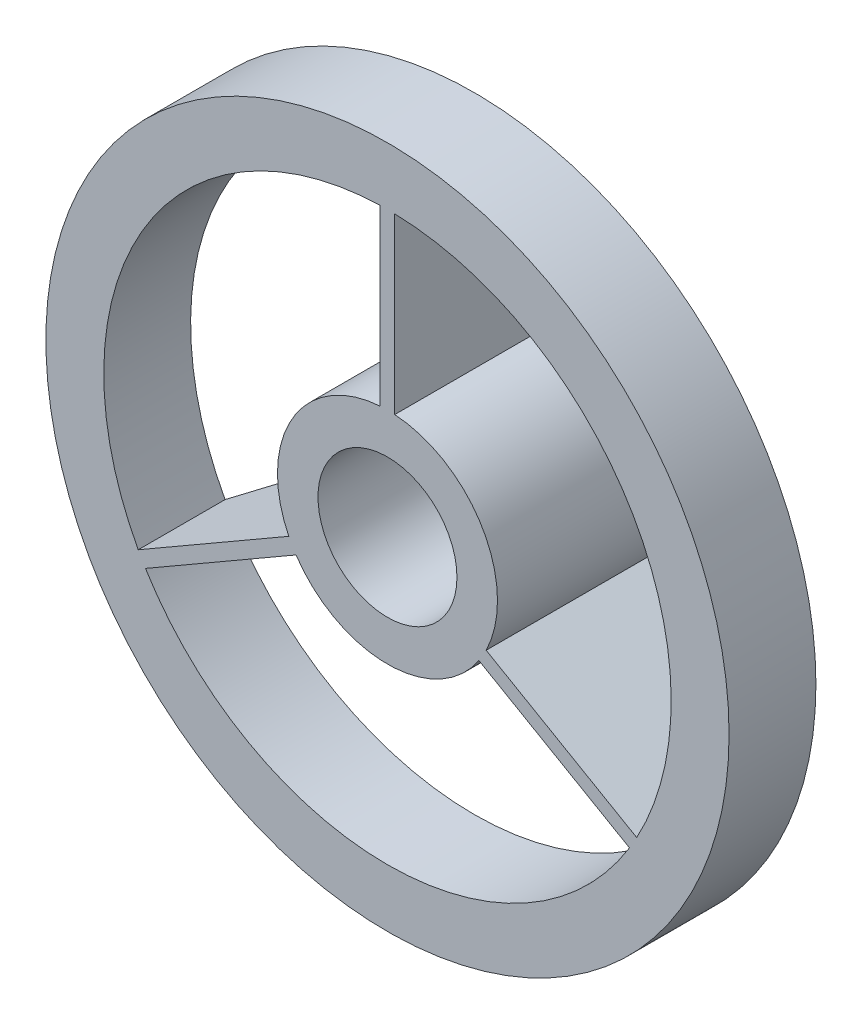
SolidWorks part; units mm, degrees
ref_plane "Front Plane" through (0, 0, 0) normal (0, 0, 1) x (1, 0, 0)
ref_plane "Top Plane" through (0, 0, 0) normal (0, 1, 0) x (1, 0, 0)
ref_plane "Right Plane" through (0, 0, 0) normal (1, 0, 0) x (0, 0, -1)
sketch "Croquis1" plane through (0, 0, 0) normal (0, 0, 1) x (1, 0, 0)
  circle A0 centre (0, 0) radius 1.2
  circle A1 centre (0, 0) radius 1.9
  dimension "D1" = 2.4
  dimension "D2" = 0.7
extrude "Saliente-Extruir1" add sketch "Croquis1" along normal blind 3.5
sketch "Croquis2" plane through (0, 0, 3.5) normal (0, 0, 1) x (1, 0, 0)
  circle A1 centre (0, 0) radius 5.9
  circle A2 centre (0, 0) radius 4.9
  circle A3 centre (0, 0) radius 4.9
  dimension "D1" = 3
  dimension "D2" = 1
extrude "Saliente-Extruir2" add sketch "Croquis2" against normal blind 1.5 separate body
sketch "Croquis4" plane through (0, 0, 0) normal (1, 0, 0) x (0, 0, -1)
  line L1 (0, -1.9) -> (0, 1.9) construction
  line L2 (-3.5, 1.9) -> (-3.5, -1.9) construction
  line L3 (-3.5, 5.9) -> (-3.5, -5.9) construction
  line L4 (-3.5, 1.9) -> (-3.5, 4.9)
  line L5 (-3.5, 4.9) -> (-3.5, -4.9) construction
  line L6 (-3.5, 4.9) -> (-2, 4.9)
  line L7 (-2, -4.9) -> (-2, 4.9) construction
  line L8 (-2, -5.9) -> (-2, 5.9) construction
  line L9 (-2, 4.9) -> (0, 1.9)
  line L10 (0, 1.7) -> (-3.5, 1.7)
  line L11 (-3.5, 1.9) -> (-3.5, 1.7)
  line L12 (0, 1.9) -> (0, 1.7)
extrude "Saliente-Extruir3" add sketch "Croquis4" along normal mid plane 0.25
pattern_circular "MatrizC1" count 3 over 360 about axis through (0, 0, 0) along (0, 0, 1) of "Saliente-Extruir3"
